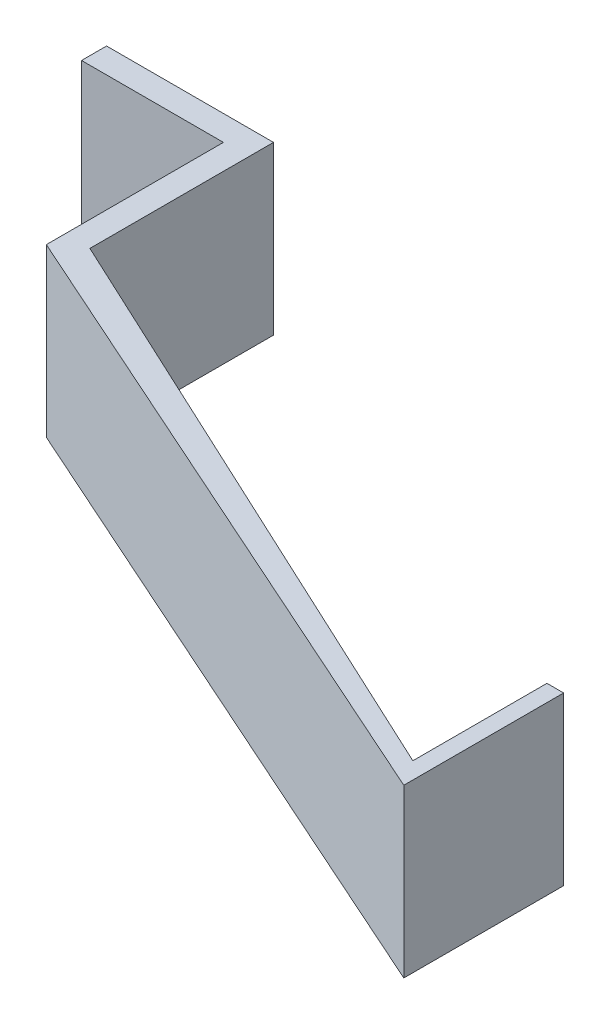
SolidWorks part; units mm, degrees
ref_plane "Front Plane" through (0, 0, 0) normal (0, 0, 1) x (1, 0, 0)
ref_plane "Top Plane" through (0, 0, 0) normal (0, 1, 0) x (1, 0, 0)
ref_plane "Right Plane" through (0, 0, 0) normal (1, 0, 0) x (0, 0, -1)
sketch "Sketch1" plane through (0, 0, 0) normal (0, 1, 0) x (1, 0, 0)
  line L0 (0, 0) -> (0, 22)
  line L1 (0, 22) -> (-20, 22)
  line L2 (-20, 22) -> (-20, 19)
  line L3 (-20, 19) -> (-3, 19)
  line L4 (-3, 19) -> (-3, -2.2141)
  line L5 (-3, -2.2141) -> (74.5046, -36.8955)
  line L6 (74.5046, -36.8955) -> (74.5046, -25.4495)
  line L7 (74.5046, -25.4495) -> (74.5046, -17.7453)
  line L8 (74.5046, -17.7453) -> (72.5046, -17.7453)
  line L9 (72.5046, -17.7453) -> (72.5046, -33.8095)
  line L10 (72.5046, -33.8095) -> (0, 0)
  line L11 (72.5046, -33.8095) -> (-3, -33.8095) construction
  dimension "D1" = 20
  dimension "D2" = 3
  dimension "D3" = 3
  dimension "D4" = 2
  dimension "D5" = 22
  dimension "D6" = 90
  dimension "D7" = 25
  dimension "D8" = 2
  dimension "D9" = 80
  dimension "D10" = 94.5046
  dimension "D11" = 3.7286
extrude "Boss-Extrude2" add sketch "Sketch1" along normal blind 20
